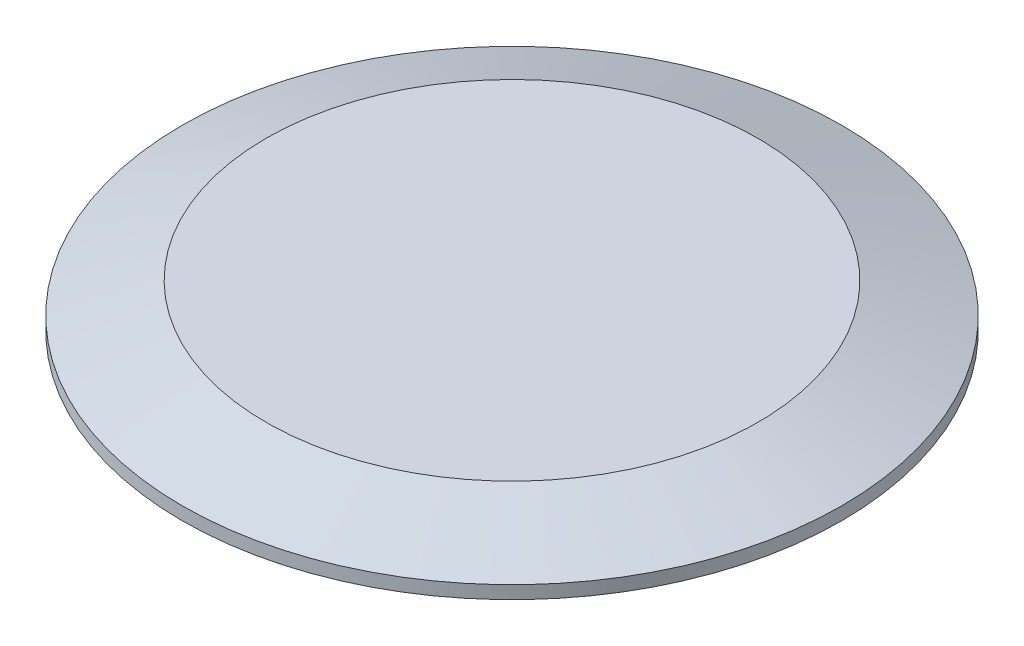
SolidWorks part; units mm, degrees
ref_plane "Front Plane" through (0, 0, 0) normal (0, 0, 1) x (1, 0, 0)
ref_plane "Top Plane" through (0, 0, 0) normal (0, 1, 0) x (1, 0, 0)
ref_plane "Right Plane" through (0, 0, 0) normal (1, 0, 0) x (0, 0, -1)
sketch "Sketch1" plane through (0, 0, 0) normal (0, 0, 1) x (1, 0, 0)
  line L0 (0, 0) -> (-65.6444, 0)
  line L1 (-72.2884, 0) -> (-72.2884, 2.8448)
  line L2 (-72.2884, 2.8448) -> (-53.9347, 9.525)
  line L3 (-53.9347, 9.525) -> (0, 9.525)
  line L4 (0, 9.525) -> (0, 0) construction
  line L5 (-69.2804, 0) -> (-72.2884, 0)
  line L6 (0, 0) -> (0, 9.525)
  arc A0 (-66.3669, 0.4745) -> (-68.5579, 0.4745) centre (-67.4624, 0) ccw
  arc A1 (-65.6444, 0) -> (-66.3669, 0.4745) centre (-65.6444, 0.7874) cw
  arc A2 (-69.2804, 0) -> (-68.5579, 0.4745) centre (-69.2804, 0.7874) ccw
  point P13 (-68.6562, 0)
  dimension "D1" = 2.3876
  dimension "D2" = 0.7874
  dimension "D3" = 72.2884
  dimension "D4" = 67.4624
  dimension "D5" = 2.8448
  dimension "D6" = 20
  dimension "D7" = 9.525
revolve "Revolve1" add sketch "Sketch1" angle 360 about L4
